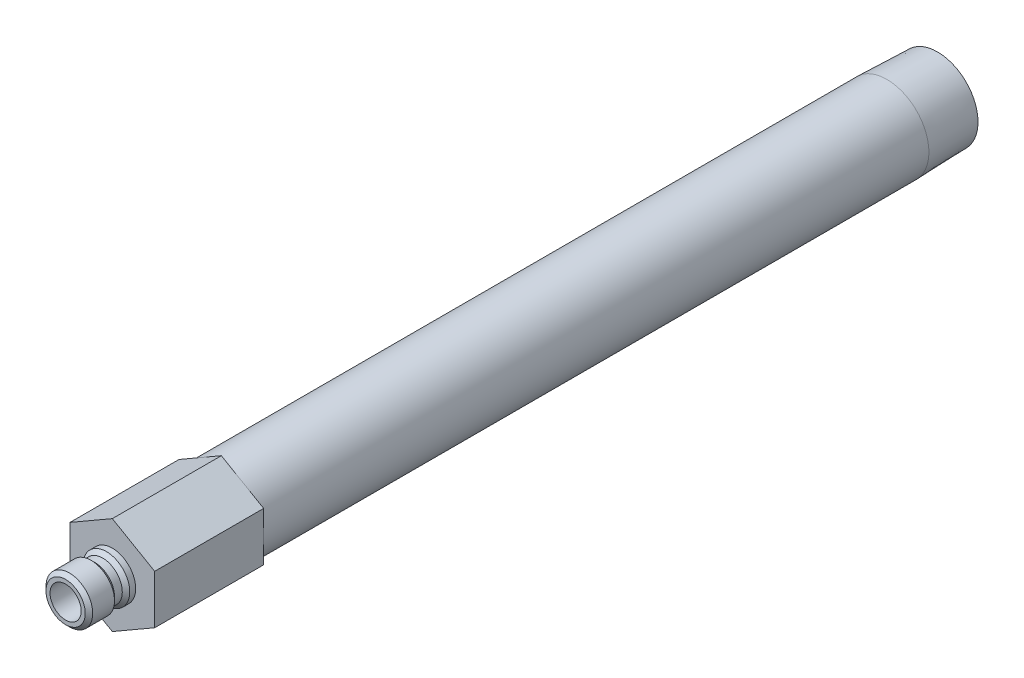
SolidWorks part; units mm, degrees
ref_plane "Front Plane" through (0, 0, 0) normal (0, 0, 1) x (1, 0, 0)
ref_plane "Top Plane" through (0, 0, 0) normal (0, 1, 0) x (1, 0, 0)
ref_plane "Right Plane" through (0, 0, 0) normal (1, 0, 0) x (0, 0, -1)
sketch "Sketch1" plane through (0, 0, 0) normal (1, 0, 0) x (0, 0, -1)
  line L0 (0, 0) -> (-12.7, 0) construction
  line L1 (-9.525, 3.175) -> (-9.525, 4.0005)
  line L2 (-3.556, 4.0005) -> (-3.556, 0) construction
  line L3 (-8.763, 4.7625) -> (-4.318, 4.7625)
  line L4 (0, 8.5725) -> (0, 0) construction
  line L5 (-3.556, 4.0005) -> (-1.9685, 4.0005)
  line L6 (-1.2065, 4.7625) -> (0, 4.7625)
  line L7 (0, 4.7625) -> (0, 8.5725)
  line L8 (-3.556, 4.0005) -> (-4.318, 4.7625)
  line L9 (-1.9685, 4.0005) -> (-1.2065, 4.7625)
  line L10 (-9.525, 4.0005) -> (-8.763, 4.7625)
  line L11 (-9.525, 3.175) -> (22.225, 3.175)
  line L12 (0, 8.5725) -> (157.9372, 8.5725)
  line L13 (157.9372, 8.5725) -> (168.275, 8.2494)
  line L14 (168.275, 8.2494) -> (168.275, 6.2611)
  line L15 (0, 0) -> (22.225, 0) construction
  line L16 (22.225, 0) -> (22.225, 3.175) construction
  line L17 (22.225, 4.7625) -> (0, 4.7625) construction
  line L18 (22.225, 3.175) -> (22.225, 6.2611)
  line L19 (22.225, 6.2611) -> (168.275, 6.2611)
  line L20 (22.225, 3.175) -> (22.225, 4.7625) construction
  dimension "D1" = 9.525
  dimension "D2" = 1.5875
  dimension "D3" = 0.762
  dimension "D4" = 45
  dimension "D5" = 5.969
  dimension "D6" = 45
  dimension "D7" = 1.79
  dimension "D8" = 10.3378
  dimension "D9" = 177.8
  dimension "D10" = 3.175
  dimension "D11" = 31.75
  dimension "D12" = 6.35
  dimension "D13" = 12.5222
  dimension "D14" = 9.525
  dimension "D15" = 17.145
revolve "Revolve1" add sketch "Sketch1" angle 360 about L0
sketch "Sketch2" plane through (0, 0, 0) normal (0, 0, 1) x (1, 0, 0)
  line L1 (-8.636, 4.986) -> (-8.636, -4.986)
  line L2 (-8.636, -4.986) -> (0, -9.972)
  line L3 (0, -9.972) -> (8.636, -4.986)
  line L4 (8.636, -4.986) -> (8.636, 4.986)
  line L5 (8.636, 4.986) -> (0, 9.972)
  line L6 (0, 9.972) -> (-8.636, 4.986)
  circle A0 centre (0, 0) radius 8.636 construction
  circle A1 centre (0, 0) radius 3.175 construction
  circle A2 centre (0, 0) radius 3.175
  dimension "D1" = 17.272
extrude "Boss-Extrude1" add sketch "Sketch2" against normal up to vertex (22.225 mm away) from vertex at 0
